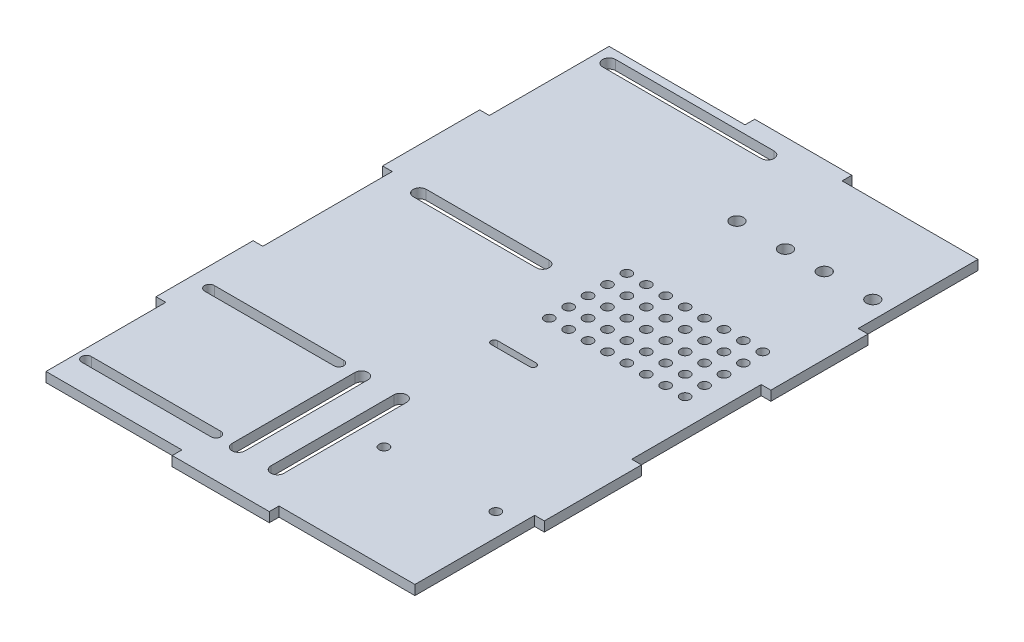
SolidWorks part; units mm, degrees
ref_plane "Front Plane" through (0, 0, 0) normal (0, 0, 1) x (1, 0, 0)
ref_plane "Top Plane" through (0, 0, 0) normal (0, 1, 0) x (1, 0, 0)
ref_plane "Right Plane" through (0, 0, 0) normal (1, 0, 0) x (0, 0, -1)
sketch "Sketch1" plane through (0, 0, 0) normal (0, 1, 0) x (1, 0, 0)
  line L1 (-60, -90) -> (60, -90)
  line L2 (-60, -90) -> (-60, 90)
  line L3 (-60, 90) -> (60, 90)
  line L4 (60, -90) -> (60, 90)
  line L5 (-60, -90) -> (60, 90) construction
  line L6 (-60, 90) -> (60, -90) construction
  point P0 (0, 0)
  dimension "D1" = 180
  dimension "D2" = 120
extrude "Boss-Extrude1" add sketch "Sketch1" along normal blind 3
sketch "Sketch2" plane through (0, 3, 0) normal (0, 1, 0) x (1, 0, 0)
  line L0 (-52.5, 80.5) -> (-3.5, 80.5) construction
  line L1 (-52.5, 80.5) -> (-3.5, 80.5)
  line L2 (-3.5, 84.5) -> (-52.5, 84.5) construction
  line L3 (-3.5, 84.5) -> (-52.5, 84.5)
  line L4 (-9, 20.5) -> (-47, 20.5) construction
  line L5 (-9, 20.5) -> (-47, 20.5)
  line L6 (-47, 16.5) -> (-9, 16.5) construction
  line L7 (-47, 16.5) -> (-9, 16.5)
  arc A0 (-52.5, 84.5) -> (-52.5, 80.5) centre (-52.5, 82.5) ccw construction
  arc A1 (-52.5, 84.5) -> (-52.5, 80.5) centre (-52.5, 82.5) ccw
  arc A2 (-3.5, 80.5) -> (-3.5, 84.5) centre (-3.5, 82.5) ccw construction
  arc A3 (-3.5, 80.5) -> (-3.5, 84.5) centre (-3.5, 82.5) ccw
  circle A4 centre (-16, -39.5) radius 1.5 construction
  circle A5 centre (-54, -77.5) radius 1.5 construction
  circle A6 centre (-16, -77.5) radius 1.5 construction
  circle A7 centre (-54, -39.5) radius 1.5 construction
  circle A8 centre (-16, -39.5) radius 1.5
  circle A9 centre (-54, -77.5) radius 1.5
  circle A10 centre (-16, -77.5) radius 1.5
  circle A11 centre (-54, -39.5) radius 1.5
  arc A12 (-47, 20.5) -> (-47, 16.5) centre (-47, 18.5) ccw construction
  arc A13 (-47, 20.5) -> (-47, 16.5) centre (-47, 18.5) ccw
  arc A14 (-9, 16.5) -> (-9, 20.5) centre (-9, 18.5) ccw construction
  arc A15 (-9, 16.5) -> (-9, 20.5) centre (-9, 18.5) ccw
  circle A16 centre (5.5, -10) radius 1 construction
  circle A17 centre (15.5, -10) radius 1 construction
  circle A18 centre (5.5, -10) radius 1
  circle A19 centre (15.5, -10) radius 1
  circle A20 centre (15.4246, -55) radius 1.5 construction
  circle A21 centre (15.4246, -55) radius 1.5
  circle A22 centre (50, -55) radius 1.5 construction
  circle A23 centre (50, -55) radius 1.5
  circle A24 centre (9.5, 60) radius 2 construction
  circle A25 centre (9.5, 60) radius 2
  circle A26 centre (24.5, 60) radius 2 construction
  circle A27 centre (24.5, 60) radius 2
  circle A28 centre (36.5, 60) radius 2 construction
  circle A29 centre (36.5, 60) radius 2
  circle A30 centre (51.5, 60) radius 2 construction
  circle A31 centre (51.5, 60) radius 2
extrude "Cut-Extrude1" cut sketch "Sketch2" against normal through all
sketch "Sketch3" plane through (0, 3, 0) normal (0, 1, 0) x (1, 0, 0)
  line L0 (-60, 90) -> (-60, 50)
  line L1 (-60, 90) -> (-57, 90)
  line L2 (-60, 50) -> (-57, 50)
  line L3 (-57, 90) -> (-57, 50)
  line L4 (-60, 90) -> (-60, -90) construction
  line L5 (-60, -90) -> (-57, -90)
  line L6 (-60, -90) -> (-60, -50)
  line L7 (-57, -90) -> (-57, -50)
  line L8 (-60, -50) -> (-57, -50)
  line L9 (-60, -90) -> (60, -90) construction
  line L10 (-60, -20) -> (-57, -20)
  line L11 (-60, -20) -> (-60, 20)
  line L12 (-57, -20) -> (-57, 20)
  line L13 (-60, 20) -> (-57, 20)
  point P17 (-58.5, -50)
  dimension "D1" = 3
  dimension "D2" = 30
  dimension "D3" = 30
extrude "Cut-Extrude2" cut sketch "Sketch3" against normal blind 10
mirror "Mirror1" about plane through (0, 0, 0) normal (1, 0, 0) of "Cut-Extrude2"
sketch "Sketch4" plane through (0, 3, 0) normal (0, 1, 0) x (1, 0, 0)
  line L0 (-15, -90) -> (15, -90)
  line L1 (-15, -90) -> (-15, -87)
  line L2 (15, -90) -> (15, -87)
  line L3 (-15, -87) -> (15, -87)
  line L4 (-57, -90) -> (57, -90) construction
  line L5 (0, 0) -> (0, -87) construction
  line L7 (-57, -90) -> (-15, -90)
  line L8 (-57, -90) -> (-57, -87)
  line L9 (-57, -87) -> (-15, -87)
  line L10 (-15, -90) -> (-15, -87)
  line L11 (57, -90) -> (15, -90)
  line L12 (57, -90) -> (57, -87)
  line L13 (57, -87) -> (15, -87)
  line L14 (15, -90) -> (15, -87)
  dimension "D1" = 30
  dimension "D2" = 3
extrude "Cut-Extrude3" cut sketch "Sketch4" against normal blind 10 contours L9 L1 M37 M38 | L13 L2 M39 M38 | L3
mirror "Mirror2" about plane through (0, 0, 0) normal (0, 0, 1) of "Cut-Extrude3"
sketch "Sketch5" plane through (0, 3, 0) normal (0, 1, 0) x (1, 0, 0)
  line L0 (-54, -39.5) -> (-14, -39.5) construction
  line L1 (-54, -38) -> (-14, -38)
  line L2 (-54, -41) -> (-14, -41)
  line L3 (-54, -77.5) -> (-14, -77.5) construction
  line L4 (-54, -76) -> (-14, -76)
  line L5 (-54, -79) -> (-14, -79)
  arc A0 (-54, -38) -> (-54, -41) centre (-54, -39.5) ccw
  arc A1 (-14, -41) -> (-14, -38) centre (-14, -39.5) ccw
  circle A2 centre (-54, -39.5) radius 1.5 construction
  arc A3 (-54, -76) -> (-54, -79) centre (-54, -77.5) ccw
  arc A4 (-14, -79) -> (-14, -76) centre (-14, -77.5) ccw
  circle A5 centre (-54, -77.5) radius 1.5 construction
  point P3 (-34, -39.5)
  point P13 (-34, -77.5)
  dimension "D1" = 40
  dimension "D2" = 40
extrude "Cut-Extrude4" cut sketch "Sketch5" against normal blind 3
sketch "Sketch6" plane through (0, 3, 0) normal (0, 1, 0) x (1, 0, 0)
  line L0 (4.5, -10) -> (16.5, -10) construction
  line L1 (4.5, -9) -> (16.5, -9)
  line L2 (4.5, -11) -> (16.5, -11)
  circle A0 centre (5.5, -10) radius 1 construction
  circle A1 centre (15.5, -10) radius 1 construction
  arc A2 (4.5, -9) -> (4.5, -11) centre (4.5, -10) ccw
  arc A3 (16.5, -11) -> (16.5, -9) centre (16.5, -10) ccw
  point P7 (10.5, -10)
extrude "Cut-Extrude5" cut sketch "Sketch6" against normal blind 3
sketch "Sketch7" plane through (0, 3, 0) normal (0, 1, 0) x (1, 0, 0)
  line L0 (-7, -39.5) -> (-7, -77.5) construction
  line L1 (-5, -39.5) -> (-5, -77.5)
  line L2 (-9, -39.5) -> (-9, -77.5)
  line L3 (5, -39.5) -> (5, -77.5) construction
  line L4 (7, -39.5) -> (7, -77.5)
  line L5 (3, -39.5) -> (3, -77.5)
  line L6 (-7, -77.5) -> (-16, -77.5) construction
  line L7 (-7, -39.5) -> (-16, -39.5) construction
  arc A0 (-5, -39.5) -> (-9, -39.5) centre (-7, -39.5) ccw
  arc A1 (-9, -77.5) -> (-5, -77.5) centre (-7, -77.5) ccw
  arc A2 (7, -39.5) -> (3, -39.5) centre (5, -39.5) ccw
  arc A3 (3, -77.5) -> (7, -77.5) centre (5, -77.5) ccw
  point P2 (-7, -58.5)
  point P7 (5, -58.5)
  dimension "D1" = 2
  dimension "D2" = 12
  dimension "D3" = 9
extrude "Cut-Extrude6" cut sketch "Sketch7" against normal blind 10
sketch "Sketch9" plane through (0, 3, 0) normal (0, 1, 0) x (1, 0, 0)
  line L0 (0.5, -27.5) -> (0.5, 86.5) construction
  line L1 (8, 35) -> (26, 35) construction
  circle A0 centre (6.5, 29) radius 1.5
  circle A1 centre (12.5, 29) radius 1.5
  circle A2 centre (18.5, 29) radius 1.5
  circle A3 centre (24.5, 29) radius 1.5
  circle A4 centre (30.5, 29) radius 1.5
  circle A5 centre (36.5, 29) radius 1.5
  circle A6 centre (42.5, 29) radius 1.5
  circle A7 centre (48.5, 29) radius 1.5
  circle A8 centre (12.5, 23) radius 1.5
  circle A9 centre (18.5, 23) radius 1.5
  circle A10 centre (24.5, 23) radius 1.5
  circle A11 centre (30.5, 23) radius 1.5
  circle A12 centre (36.5, 23) radius 1.5
  circle A13 centre (42.5, 23) radius 1.5
  circle A14 centre (48.5, 23) radius 1.5
  circle A15 centre (12.5, 17) radius 1.5
  circle A16 centre (18.5, 17) radius 1.5
  circle A17 centre (24.5, 17) radius 1.5
  circle A18 centre (30.5, 17) radius 1.5
  circle A19 centre (36.5, 17) radius 1.5
  circle A20 centre (42.5, 17) radius 1.5
  circle A21 centre (48.5, 17) radius 1.5
  circle A22 centre (12.5, 11) radius 1.5
  circle A23 centre (18.5, 11) radius 1.5
  circle A24 centre (24.5, 11) radius 1.5
  circle A25 centre (30.5, 11) radius 1.5
  circle A26 centre (36.5, 11) radius 1.5
  circle A27 centre (42.5, 11) radius 1.5
  circle A28 centre (48.5, 11) radius 1.5
  circle A29 centre (12.5, 5) radius 1.5
  circle A30 centre (18.5, 5) radius 1.5
  circle A31 centre (24.5, 5) radius 1.5
  circle A32 centre (30.5, 5) radius 1.5
  circle A33 centre (36.5, 5) radius 1.5
  circle A34 centre (42.5, 5) radius 1.5
  circle A35 centre (48.5, 5) radius 1.5
  circle A36 centre (6.5, 23) radius 1.5
  circle A37 centre (6.5, 17) radius 1.5
  circle A38 centre (6.5, 11) radius 1.5
  circle A39 centre (6.5, 5) radius 1.5
  dimension "D1" = 3
  dimension "D2" = 6
  dimension "D3" = 6
  dimension "D4" = 8
  dimension "D5" = 5
extrude "Cut-Extrude7" cut sketch "Sketch9" against normal blind 10
